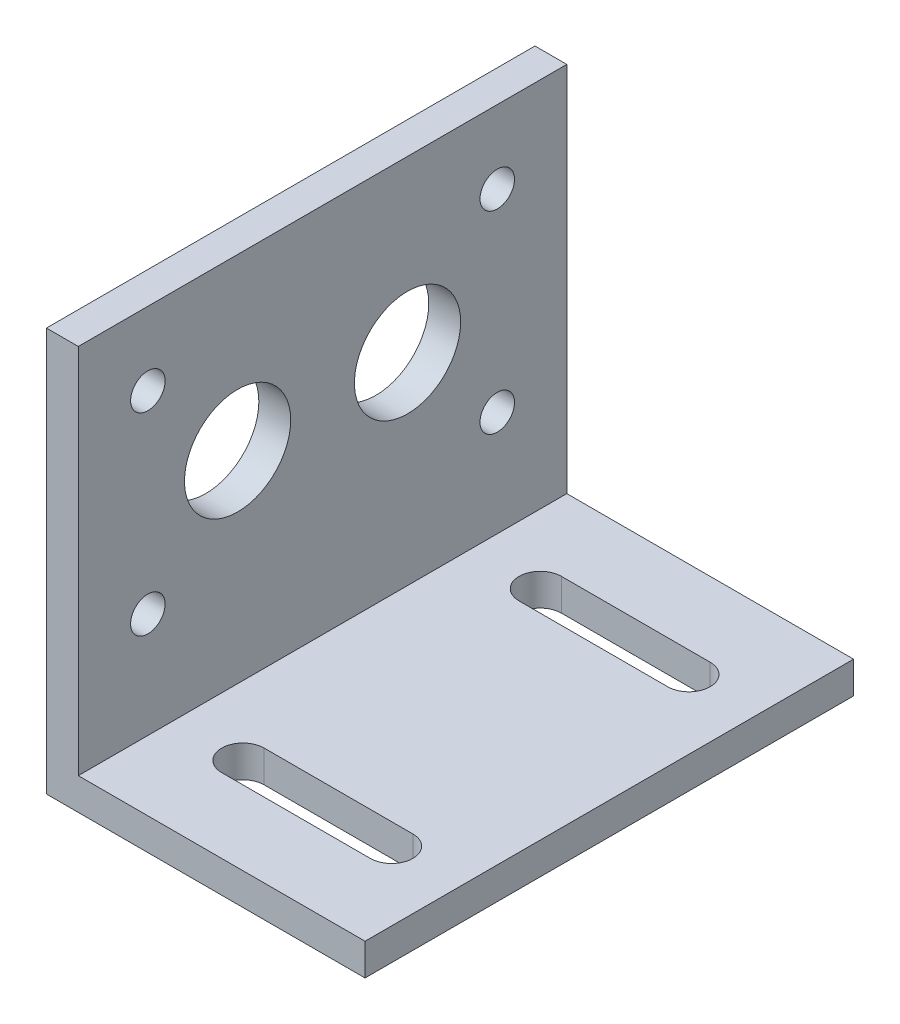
SolidWorks part; units mm, degrees
ref_plane "Front Plane" through (0, 0, 0) normal (0, 0, 1) x (1, 0, 0)
ref_plane "Top Plane" through (0, 0, 0) normal (0, 1, 0) x (1, 0, 0)
ref_plane "Right Plane" through (0, 0, 0) normal (1, 0, 0) x (0, 0, -1)
sketch "Sketch1" plane through (0, 0, 0) normal (0, 0, 1) x (1, 0, 0)
  line L0 (0, 0) -> (-30, 0)
  line L1 (-30, 0) -> (-30, 38)
  line L2 (0, 3) -> (-27, 3)
  line L3 (-27, 3) -> (-27, 38)
  line L4 (0, 0) -> (0, 3)
  line L5 (-30, 38) -> (-27, 38)
  dimension "D1" = 30
  dimension "D2" = 38
  dimension "D3" = 3
extrude "Boss-Extrude1" add sketch "Sketch1" along normal mid plane 46
sketch "Sketch2" plane through (0, 3, 0) normal (0, 1, 0) x (1, 0, 0)
  line L0 (-6.5, -14) -> (-20.5, -14) construction
  line L1 (-6.5, -16) -> (-20.5, -16)
  line L2 (-6.5, -12) -> (-20.5, -12)
  line L3 (0, -23) -> (0, 23) construction
  line L4 (0, 0) -> (-27, 0) construction
  line L5 (-27, -23) -> (-27, 23) construction
  line L6 (-6.5, 14) -> (-20.5, 14) construction
  line L7 (-6.5, 16) -> (-20.5, 16)
  line L8 (-6.5, 12) -> (-20.5, 12)
  arc A0 (-6.5, -16) -> (-6.5, -12) centre (-6.5, -14) ccw
  arc A1 (-20.5, -12) -> (-20.5, -16) centre (-20.5, -14) ccw
  arc A2 (-6.5, 16) -> (-6.5, 12) centre (-6.5, 14) cw
  arc A3 (-20.5, 12) -> (-20.5, 16) centre (-20.5, 14) cw
  point P2 (-13.5, -14)
  point P16 (-13.5, 14)
  dimension "D1" = 14
  dimension "D2" = 4
  dimension "D3" = 6.5
  dimension "D4" = 14
extrude "Cut-Extrude1" cut sketch "Sketch2" against normal through all
sketch "Sketch3" plane through (-27, 0, 0) normal (1, 0, 0) x (0, 0, -1)
  line L0 (0, 0) -> (0, 38) construction
  line L1 (-23, 38) -> (23, 38) construction
  line L3 (23, 3) -> (23, 38) construction
  circle A0 centre (-16.45, 31.11) radius 3.63
  circle A1 centre (-16.45, 31.11) radius 1.625
  circle A2 centre (-16.45, 12.91) radius 3.63
  circle A3 centre (-16.45, 12.91) radius 1.625
  circle A4 centre (16.45, 12.91) radius 1.625
  circle A5 centre (16.45, 12.91) radius 3.63
  circle A6 centre (16.45, 31.11) radius 1.625
  circle A7 centre (16.45, 31.11) radius 3.63
  circle A8 centre (8, 22) radius 5
  circle A9 centre (-8, 22) radius 5
  dimension "D1" = 7.26
  dimension "D2" = 3.25
  dimension "D3" = 7.26
  dimension "D4" = 3.25
  dimension "D8" = 10
  dimension "D5" = 18.2
  dimension "D6" = 6.89
  dimension "D7" = 32.9
  dimension "D9" = 15
  dimension "D10" = 16
extrude "Cut-Extrude2" cut sketch "Sketch3" against normal through all contours A1 | A9 | A3 | A8 | A6 | A4
